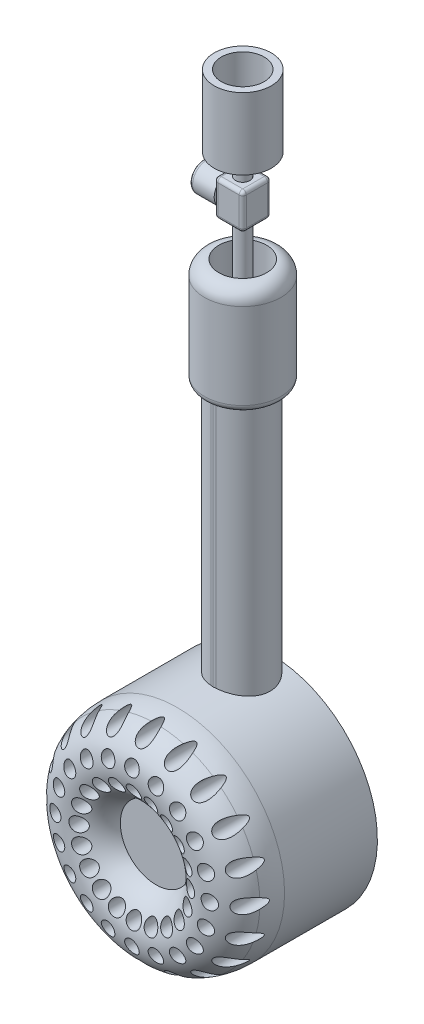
SolidWorks part; units mm, degrees
ref_plane "Front Plane" through (0, 0, 0) normal (0, 0, 1) x (1, 0, 0)
ref_plane "Top Plane" through (0, 0, 0) normal (0, 1, 0) x (1, 0, 0)
ref_plane "Right Plane" through (0, 0, 0) normal (1, 0, 0) x (0, 0, -1)
sketch "Sketch1" plane through (0, 0, 0) normal (0, 0, 1) x (1, 0, 0)
  circle A0 centre (0, 0) radius 15
  dimension "D1" = 30
extrude "Boss-Extrude1" add sketch "Sketch1" along normal blind 15
fillet "Fillet1" radius 10 1 edges at (15, 0, 15)
sketch "Sketch2" plane through (0, 0, 15) normal (0, 0, 1) x (1, 0, 0)
  circle A0 centre (0, 0) radius 5
  dimension "D1" = 10
extrude "Cut-Extrude1" cut sketch "Sketch2" against normal blind 7
fillet "Fillet4" radius 5 1 edges at (5, 0, 15)
sketch "Sketch5" plane through (0, 0, 0) normal (0, 0, -1) x (-1, 0, 0)
  circle A0 centre (0, 13.8126) radius 1
  circle A1 centre (0, 10.8126) radius 1
  circle A2 centre (0, 7.8126) radius 1
  circle A5 centre (4.2683, 13.1365) radius 1
  circle A6 centre (3.3413, 10.2834) radius 1
  circle A7 centre (2.4142, 7.4302) radius 1
  circle A8 centre (8.1188, 11.1746) radius 1
  circle A9 centre (6.3555, 8.7476) radius 1
  circle A10 centre (4.5921, 6.3205) radius 1
  circle A11 centre (11.1746, 8.1188) radius 1
  circle A12 centre (8.7476, 6.3555) radius 1
  circle A13 centre (6.3205, 4.5921) radius 1
  circle A14 centre (13.1365, 4.2683) radius 1
  circle A15 centre (10.2834, 3.3413) radius 1
  circle A16 centre (7.4302, 2.4142) radius 1
  circle A17 centre (13.8126, 0) radius 1
  circle A18 centre (10.8126, 0) radius 1
  circle A19 centre (7.8126, 0) radius 1
  circle A20 centre (13.1365, -4.2683) radius 1
  circle A21 centre (10.2834, -3.3413) radius 1
  circle A22 centre (7.4302, -2.4142) radius 1
  circle A23 centre (11.1746, -8.1188) radius 1
  circle A24 centre (8.7476, -6.3555) radius 1
  circle A25 centre (6.3205, -4.5921) radius 1
  circle A26 centre (8.1188, -11.1746) radius 1
  circle A27 centre (6.3555, -8.7476) radius 1
  circle A28 centre (4.5921, -6.3205) radius 1
  circle A29 centre (4.2683, -13.1365) radius 1
  circle A30 centre (3.3413, -10.2834) radius 1
  circle A31 centre (2.4142, -7.4302) radius 1
  circle A32 centre (0, -13.8126) radius 1
  circle A33 centre (0, -10.8126) radius 1
  circle A34 centre (0, -7.8126) radius 1
  circle A35 centre (-4.2683, -13.1365) radius 1
  circle A36 centre (-3.3413, -10.2834) radius 1
  circle A37 centre (-2.4142, -7.4302) radius 1
  circle A38 centre (-8.1188, -11.1746) radius 1
  circle A39 centre (-6.3555, -8.7476) radius 1
  circle A40 centre (-4.5921, -6.3205) radius 1
  circle A41 centre (-11.1746, -8.1188) radius 1
  circle A42 centre (-8.7476, -6.3555) radius 1
  circle A43 centre (-6.3205, -4.5921) radius 1
  circle A44 centre (-13.1365, -4.2683) radius 1
  circle A45 centre (-10.2834, -3.3413) radius 1
  circle A46 centre (-7.4302, -2.4142) radius 1
  circle A47 centre (-13.8126, 0) radius 1
  circle A48 centre (-10.8126, 0) radius 1
  circle A49 centre (-7.8126, 0) radius 1
  circle A50 centre (-13.1365, 4.2683) radius 1
  circle A51 centre (-10.2834, 3.3413) radius 1
  circle A52 centre (-7.4302, 2.4142) radius 1
  circle A53 centre (-11.1746, 8.1188) radius 1
  circle A54 centre (-8.7476, 6.3555) radius 1
  circle A55 centre (-6.3205, 4.5921) radius 1
  circle A56 centre (-8.1188, 11.1746) radius 1
  circle A57 centre (-6.3555, 8.7476) radius 1
  circle A58 centre (-4.5921, 6.3205) radius 1
  circle A59 centre (-4.2683, 13.1365) radius 1
  circle A60 centre (-3.3413, 10.2834) radius 1
  circle A61 centre (-2.4142, 7.4302) radius 1
  point P123 (0, 0)
  dimension "D1" = 2
  dimension "D2" = 3
  dimension "D3" = 3
  dimension "D4" = 20
extrude "Cut-Extrude3" cut sketch "Sketch5" against normal blind 32
sketch "Sketch6" plane through (0, 0, 0) normal (0, 0, -1) x (-1, 0, 0)
  line L2 (-1.9083, -14.8781) -> (-1.9083, 50)
  line L3 (-1.9083, 50) -> (1.9083, 50)
  line L4 (1.9083, -14.8781) -> (1.9083, 50)
  line L5 (-1.6309, -14.9111) -> (1.9083, 50) construction
  line L6 (-1.9083, 50) -> (1.6309, -14.9111) construction
  circle A0 centre (0, 0) radius 15
  spline S0 degree 3 poles (-1.9083, -14.8781) (-0.6439, -15.0403) (0.6435, -15.0409) (1.9083, -14.8781) knots 0 0 0 0 1 1 1 1
  point P3 (0, 15)
extrude "Boss-Extrude2" add sketch "Sketch6" along normal blind 8 contours L2 A0 | L4 A0 | L2 S0 A0 L4 | A0 L4 L3 L2
fillet "Fillet6" radius 2 2 edges at (1.9083, 32.4391, 0) (-1.9083, 32.4391, 0)
fillet "Fillet7" radius 2 1 edges at (-1.9083, 32.4391, -8)
fillet "Fillet8" radius 2 1 edges at (1.9083, 32.4391, -8)
sketch "Sketch7" plane through (0, 50, 0) normal (0, 1, 0) x (1, 0, 0)
  line L0 (0, 7.9979) -> (0, 0.0021) construction
  line L1 (-1.9083, 4) -> (1.9083, 4) construction
  line L2 (-1.9083, 6) -> (-1.9083, 2) construction
  line L3 (1.9083, 6) -> (1.9083, 2) construction
  circle A0 centre (0, 4) radius 3.9694
extrude "Boss-Extrude3" add sketch "Sketch7" against normal blind 48
sketch "Sketch8" plane through (0, 50, 0) normal (0, 1, 0) x (1, 0, 0)
  line L0 (0.3254, 7.956) -> (0, 0.0021) construction
  circle A0 centre (0.1627, 3.9791) radius 3.3465
extrude "Cut-Extrude4" cut sketch "Sketch8" against normal blind 48
sketch "Sketch9" plane through (0, 50, 0) normal (0, 1, 0) x (1, 0, 0)
  circle A10 centre (0.1627, 3.9791) radius 5.3465
  circle A11 centre (0.1627, 3.9791) radius 5.3465
  dimension "D1" = 2
extrude "Boss-Extrude4" add sketch "Sketch9" along normal blind 15
fillet "Fillet9" radius 2 1 edges at (0.1627, 65, 1.3674)
fillet "Fillet10" radius 1 1 edges at (0.1627, 50, 1.3674)
sketch "Sketch10" plane through (0, 65, 0) normal (0, 1, 0) x (1, 0, 0)
  circle A0 centre (0.1627, 3.9791) radius 3.3465
extrude "Cut-Extrude5" cut sketch "Sketch10" against normal blind 65
sketch "Sketch11" plane through (0, 0, 0) normal (0, 1, 0) x (1, 0, 0)
  line L0 (0.1627, 7.3256) -> (0.1627, 0.6326) construction
  circle A0 centre (0.1627, 3.9791) radius 3.3465 construction
  circle A1 centre (0.1627, 3.9791) radius 3.3465 construction
  circle A2 centre (0.1627, 3.9791) radius 1
  dimension "D1" = 2
extrude "Boss-Extrude5" add sketch "Sketch11" along normal blind 75
sketch "Sketch12" plane through (0, 75, 0) normal (0, 1, 0) x (1, 0, 0)
  line L0 (0.1627, 4.9791) -> (0.1627, 2.9791) construction
  line L2 (-1.8373, 5.9791) -> (2.1627, 5.9791)
  line L3 (-1.8373, 5.9791) -> (-1.8373, 1.9791)
  line L4 (-1.8373, 1.9791) -> (2.1627, 1.9791)
  line L5 (2.1627, 5.9791) -> (2.1627, 1.9791)
  line L6 (-1.8373, 5.9791) -> (2.1627, 1.9791) construction
  line L7 (-1.8373, 1.9791) -> (2.1627, 5.9791) construction
  circle A0 centre (0.1627, 3.9791) radius 1 construction
  circle A1 centre (0.1627, 3.9791) radius 1 construction
  point P7 (0.1627, 3.9791)
  dimension "D1" = 4
  dimension "D2" = 4
extrude "Boss-Extrude6" add sketch "Sketch12" against normal blind 5 contours L5 L4 L3 L2
fillet "Fillet11" radius 0.5 1 edges at (2.1627, 72.5, -5.9791)
fillet "Fillet12" radius 0.5 4 edges at (-0.0873, 75, -5.9791) (2.0163, 75, -5.8326) (2.1627, 75, -3.7291) (2.1627, 72.5, -1.9791)
fillet "Fillet13" radius 0.5 5 edges at (-0.0873, 70, -5.9791) (2.0163, 70, -5.8326) (-0.0873, 70, -1.9791) (2.0163, 70, -2.1255) (2.1627, 70, -3.9791)
fillet "Fillet14" radius 0.5 7 edges at (-1.8373, 74.8536, -5.8326) (-1.8373, 75, -3.7291) (-1.8373, 72.75, -1.9791) (-1.8373, 70.1464, -2.1255) (-1.8373, 70, -3.9791) (-1.8373, 70.1464, -5.8326) (-1.8373, 72.5, -5.9791)
fillet "Fillet15" radius 0.5 3 edges at (-1.6909, 74.8536, -2.1255) (2.0163, 74.8536, -2.1255) (0.1627, 75, -1.9791)
sketch "Sketch14" plane through (-1.8373, 0, 0) normal (-1, 0, 0) x (0, 0, 1)
  line L0 (-3.9791, 74.5) -> (-3.9791, 70.5) construction
  line L1 (-2.4791, 74.5) -> (-5.4791, 74.5) construction
  line L2 (-5.4791, 70.5) -> (-2.4791, 70.5) construction
  circle A0 centre (-3.9791, 72.5) radius 2
  dimension "D1" = 4
extrude "Boss-Extrude7" add sketch "Sketch14" along normal blind 3.5
sketch "Sketch15" plane through (-5.3373, 0, 0) normal (-1, 0, 0) x (0, 0, 1)
  circle A0 centre (-3.9791, 72.5) radius 1.15
  dimension "D1" = 2.3
extrude "Cut-Extrude7" cut sketch "Sketch15" against normal blind 3.5
fillet "Fillet16" radius 0.5 1 edges at (-5.3373, 72.5, -2.8291)
fillet "Fillet17" radius 0.5 1 edges at (-5.3373, 72.5, -1.9791)
sketch "Sketch16" plane through (0, 75, 0) normal (0, 1, 0) x (1, 0, 0)
  circle A0 centre (0.1627, 3.9791) radius 1
  dimension "D1" = 2
extrude "Boss-Extrude8" add sketch "Sketch16" along normal blind 3
sketch "Sketch18" plane through (0, 78, 0) normal (0, 1, 0) x (1, 0, 0)
  circle A2 centre (0.1627, 3.9791) radius 0.75
  dimension "D1" = 1.5
extrude "Cut-Extrude8" cut sketch "Sketch18" against normal blind 50
ref_plane "Plane2" through (0, 88, 0) normal (0, 1, 0) x (1, 0, 0)
sketch "Sketch20" plane through (0, 88, 0) normal (0, 1, 0) x (1, 0, 0)
  circle A0 centre (0.1627, 3.9791) radius 4
  dimension "D1" = 8
extrude "Boss-Extrude9" add sketch "Sketch20" against normal blind 10
sketch "Sketch21" plane through (0, 88, 0) normal (0, 1, 0) x (1, 0, 0)
  line L0 (0.1627, 7.9791) -> (0.1627, -0.0209) construction
  circle A0 centre (0.1627, 3.9791) radius 4 construction
  circle A1 centre (0.1627, 3.9791) radius 3
  dimension "D1" = 6
extrude "Cut-Extrude9" cut sketch "Sketch21" against normal blind 5
sketch "Sketch22" plane through (0, 83, 0) normal (0, 1, 0) x (1, 0, 0)
  circle A0 centre (0.1627, 3.9791) radius 1.5
  dimension "D1" = 3
extrude "Cut-Extrude10" cut sketch "Sketch22" against normal blind 5
